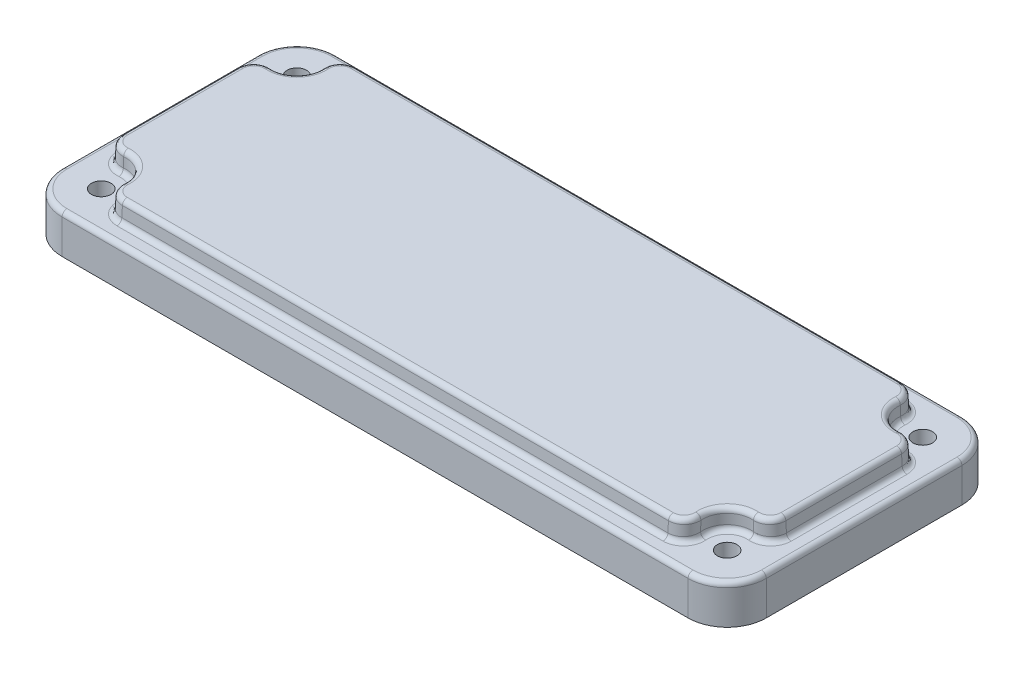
SolidWorks part; units mm, degrees
ref_plane "Front" through (0, 0, 0) normal (0, 0, 1) x (1, 0, 0)
ref_plane "Top" through (0, 0, 0) normal (0, 1, 0) x (1, 0, 0)
ref_plane "Right" through (0, 0, 0) normal (1, 0, 0) x (0, 0, -1)
sketch "Sketch1" plane through (0, 0, 0) normal (0, 1, 0) x (1, 0, 0)
  line L0 (-50.8, 22.225) -> (50.8, 22.225)
  line L1 (-57.15, 15.875) -> (-57.15, -15.875)
  line L2 (50.8, -22.225) -> (-50.8, -22.225)
  line L3 (57.15, -15.875) -> (57.15, 15.875)
  line L4 (-50.8, -15.875) -> (50.8, 15.875) construction
  arc A0 (-57.15, -15.875) -> (-50.8, -22.225) centre (-50.8, -15.875) ccw
  arc A1 (57.15, -15.875) -> (50.8, -22.225) centre (50.8, -15.875) cw
  arc A2 (50.8, 22.225) -> (57.15, 15.875) centre (50.8, 15.875) cw
  arc A3 (-50.8, 22.225) -> (-57.15, 15.875) centre (-50.8, 15.875) ccw
  dimension "D1" = 114.3
  dimension "D2" = 44.45
  dimension "D4" = 6.35
extrude "Base-Extrude" add sketch "Sketch1" along normal blind 6.35
sketch "Sketch2" plane through (0, 6.35, 0) normal (0, 1, 0) x (-1, 0, 0)
  line L4 (50.8, 19.05) -> (-50.8, 19.05)
  line L5 (-53.975, 15.875) -> (-53.975, -15.875)
  line L6 (-50.8, -19.05) -> (50.8, -19.05)
  line L7 (53.975, -15.875) -> (53.975, 15.875)
  line L8 (50.8, 19.05) -> (-50.8, 19.05)
  line L9 (-53.975, 15.875) -> (-53.975, -15.875)
  line L10 (-50.8, -19.05) -> (50.8, -19.05)
  line L11 (53.975, -15.875) -> (53.975, 15.875)
  arc A4 (53.975, 15.875) -> (50.8, 19.05) centre (50.8, 15.875) ccw
  arc A5 (53.975, 15.875) -> (50.8, 19.05) centre (50.8, 15.875) ccw
  arc A6 (-50.8, 19.05) -> (-53.975, 15.875) centre (-50.8, 15.875) ccw
  arc A7 (-50.8, 19.05) -> (-53.975, 15.875) centre (-50.8, 15.875) ccw
  arc A8 (-53.975, -15.875) -> (-50.8, -19.05) centre (-50.8, -15.875) ccw
  arc A9 (-53.975, -15.875) -> (-50.8, -19.05) centre (-50.8, -15.875) ccw
  arc A10 (50.8, -19.05) -> (53.975, -15.875) centre (50.8, -15.875) ccw
  arc A11 (50.8, -19.05) -> (53.975, -15.875) centre (50.8, -15.875) ccw
  dimension "D1" = 3.175
extrude "Boss-Extrude1" add sketch "Sketch2" along normal blind 3.175 draft 3
sketch "Sketch3" plane through (0, 9.525, 0) normal (0, 1, 0) x (-1, 0, 0)
  circle A0 centre (-50.8, 15.875) radius 3.9687
  dimension "D1" = 7.9375
extrude "Cut-Extrude1" cut sketch "Sketch3" against normal up to surface (3.175 mm away)
sketch "Sketch4" plane through (0, 6.35, 0) normal (0, 1, 0) x (-1, 0, 0)
  circle A0 centre (-50.8, 15.875) radius 1.5875
  dimension "D1" = 3.175
extrude "Cut-Extrude2" cut sketch "Sketch4" against normal through all
mirror "Mirror1" about plane through (0, 0, 0) normal (0, 0, 1) of "Cut-Extrude2", "Cut-Extrude1"
mirror "Mirror2" about plane through (0, 0, 0) normal (1, 0, 0) of "Mirror1", "Cut-Extrude1", "Cut-Extrude2"
fillet "Fillet1" radius 2.54 8 edges at (-53.8935, 7.9044, 13.3888) (53.8935, 7.9044, 13.3888) (48.3138, 7.9044, 18.9685) (53.8935, 7.9044, -13.3888) (48.3138, 7.9044, -18.9685) (-53.8935, 7.9044, -13.3888) (-48.3138, 7.9044, -18.9685) (-48.3138, 7.9044, 18.9685)
fillet "Fillet2" radius 0.7937 56 edges at (55.2901, 6.35, 20.3651) (0, 6.35, 19.05) (0, 9.525, 18.8836) (-44.315, 7.9366, 18.9668) (44.315, 7.9366, 18.9668) (-53.8086, 9.525, 0) (-47.9937, 9.525, 13.0687) (47.9937, 9.525, 13.0687) (53.8086, 9.525, 0) (47.9937, 9.525, -13.0687) (0, 9.525, -18.8836) (-47.9937, 9.525, -13.0687) (-46.3986, 9.525, 17.785) (-53.2526, 9.525, 10.9683) (-52.71, 9.525, -11.4736) (-45.8933, 9.525, -18.3276) (46.3986, 9.525, -17.785) (53.2526, 9.525, -10.9683) (52.71, 9.525, 11.4736) (45.8933, 9.525, 18.3276) (47.9937, 6.35, 13.0687) (51.1344, 7.9366, 11.9204) (46.8454, 7.9366, 16.2094) (53.975, 6.35, 0) (53.8918, 7.9366, -9.39) (53.8918, 7.9366, 9.39) (47.9937, 6.35, -13.0687) (46.8454, 7.9366, -16.2094) (51.1344, 7.9366, -11.9204) (57.15, 6.35, 0) (0, 6.35, -19.05) (-44.315, 7.9366, -18.9668) (44.315, 7.9366, -18.9668) (-47.9937, 6.35, -13.0687) (-51.1344, 7.9366, -11.9204) (-46.8454, 7.9366, -16.2094) (-53.975, 6.35, 0) (-53.8918, 7.9366, 9.39) (-53.8918, 7.9366, -9.39) (-47.9937, 6.35, 13.0687) (-46.8454, 7.9366, 16.2094) (-51.1344, 7.9366, 11.9204) (46.2919, 6.35, 18.1127) (53.2408, 6.35, 11.1827) (53.0648, 6.35, -11.3446) (46.1444, 6.35, -18.2787) (-46.2625, 6.35, -18.1482) (-53.2213, 6.35, -11.2022) (-53.0383, 6.35, 11.3664) (-46.1066, 6.35, 18.3169) (55.2901, 6.35, -20.3651) (0, 6.35, -22.225) (-55.2901, 6.35, -20.3651) (-57.15, 6.35, 0) (-55.2901, 6.35, 20.3651) (0, 6.35, 22.225)
sketch "Sketch5" plane through (0, 0, 0) normal (0, -1, 0) x (1, 0, 0)
  line L0 (-44.45, 15.875) -> (44.45, 15.875)
  line L1 (-44.45, 15.875) -> (-44.45, -15.875)
  line L2 (44.45, -15.875) -> (-44.45, -15.875)
  line L3 (44.45, -15.875) -> (44.45, 15.875)
  line L4 (50.8, 22.225) -> (-50.8, 22.225) construction
  line L5 (57.15, 15.875) -> (57.15, -15.875) construction
  line L6 (-57.15, -15.875) -> (-57.15, 15.875) construction
  line L7 (-50.8, -22.225) -> (50.8, -22.225) construction
  dimension "D1" = 6.35
  dimension "D2" = 12.7
  dimension "D3" = 12.7
  dimension "D4" = 6.35
extrude "Cut-Extrude3" cut sketch "Sketch5" against normal blind 6.35 draft 3
fillet "Fillet3" radius 6.35 4 edges at (-44.2836, 3.175, -15.7086) (-44.2836, 3.175, 15.7086) (44.2836, 3.175, 15.7086) (44.2836, 3.175, -15.7086)
fillet "Fillet4" radius 3.175 8 edges at (-44.1172, 6.35, 0) (0, 6.35, 15.5422) (0, 6.35, -15.5422) (44.1172, 6.35, 0) (-42.2609, 6.35, -13.6859) (42.2609, 6.35, 13.6859) (42.2609, 6.35, -13.6859) (-42.2609, 6.35, 13.6859)
